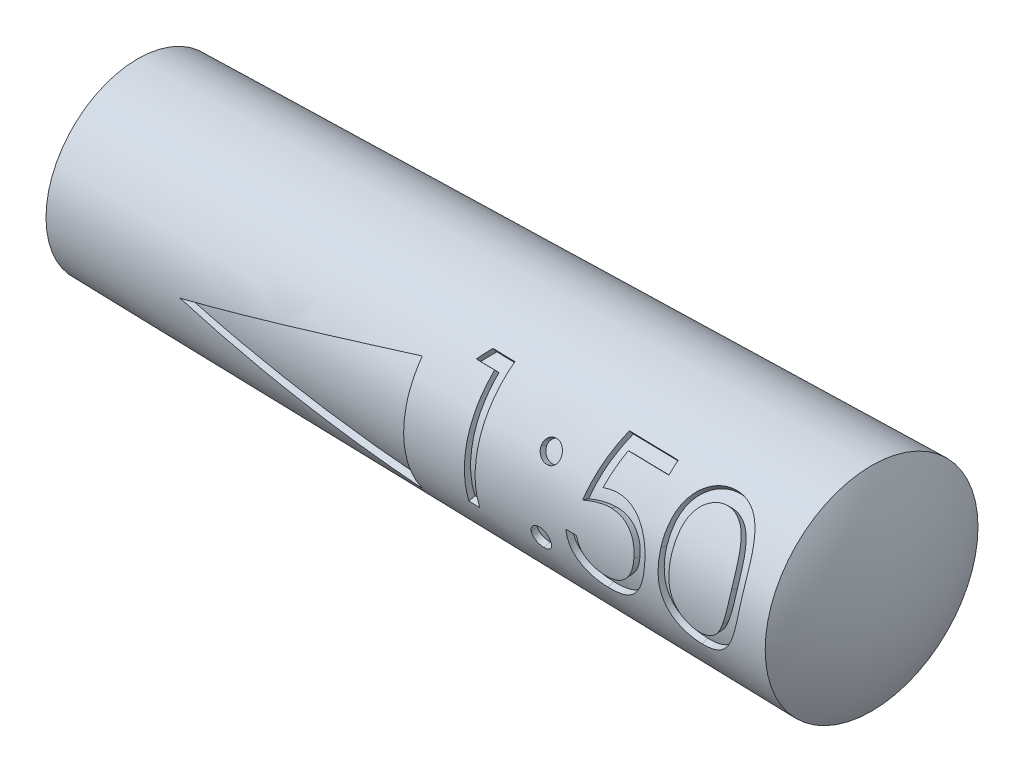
SolidWorks part; units mm, degrees
ref_plane "Front Plane" through (0, 0, 0) normal (0, 0, 1) x (1, 0, 0)
ref_plane "Top Plane" through (0, 0, 0) normal (0, 1, 0) x (1, 0, 0)
ref_plane "Right Plane" through (0, 0, 0) normal (1, 0, 0) x (0, 0, -1)
sketch "Sketch1" plane through (0, 0, 0) normal (1, 0, 0) x (0, 0, -1)
  circle A0 centre (0, 0) radius 0.75
  dimension "D1" = 1.5
extrude "Extrude1" add sketch "Sketch1" along normal mid plane 6
draft "Draft1" type of draft neutral plane draft angle 1.146 faces to draft 1 parameters "D1"=1.146
sketch "Sketch2" plane through (0, 0, 0) normal (0, 0, 1) x (1, 0, 0)
  line L0 (-3, 0) -> (-3, 0.75)
  line L1 (-3, 0.75) -> (-3, -0.75) construction
  line L2 (-3, 0) -> (-3.23, 0)
  line L3 (-3.23, 0) -> (-3.23, -0.81) construction
  line L4 (3, 0) -> (3, 0.87)
  line L5 (3, -0.87) -> (3, 0.87) construction
  line L6 (3, 0) -> (3.23, 0)
  line L7 (3.23, 0) -> (3.23, -0.81) construction
  line L8 (-3, -0.75) -> (3, -0.87) construction
  arc A0 (-3.23, 0) -> (-3, 0.75) centre (-1.8922, 0) cw
  arc A1 (3.23, 0) -> (3, 0.87) centre (1.4696, 0) ccw
  point P14 (0, -0.81)
revolve "Revolve1" add sketch "Sketch2" angle 360 about L2
sketch "Sketch5" plane through (0, 0, 0) normal (0, 0, 1) x (1, 0, 0)
  line L0 (0, 0.81) -> (0, -0.81) construction
  line L1 (3, 0.87) -> (-3, 0.75) construction
  line L2 (-3, -0.75) -> (3, -0.87) construction
ref_plane "Plane2" through (0, 0, 0) normal (-0.02, 0, 0.9998) x (0.9998, 0, 0.02)
sketch "Sketch6" plane through (0, 0, 0) normal (-0.02, 0, 0.9998) x (0.9998, 0, 0.02)
  line L0 (0, 0) -> (0, 0.5)
  line L1 (0, 0.81) -> (0, -0.81) construction
  line L2 (0, 0.5) -> (-1.866, 0)
  line L3 (-1.866, 0) -> (0, -0.5)
  line L4 (0, -0.5) -> (0, 0)
  line L5 (0, -0.25) -> (3, -0.25) construction
  text T0 "1:50" font "Century Gothic" height 1
  dimension "D1" = 1
  dimension "D2" = 30
  dimension "D3" = 3
wrap "Wrap2" sketch "Sketch6" wrap type deboss source sketch "Sketch6" thickness 0.05 parameters "D1"=0.05
equation "\"D2@Sketch2\" = \"D1@Sketch2\""
